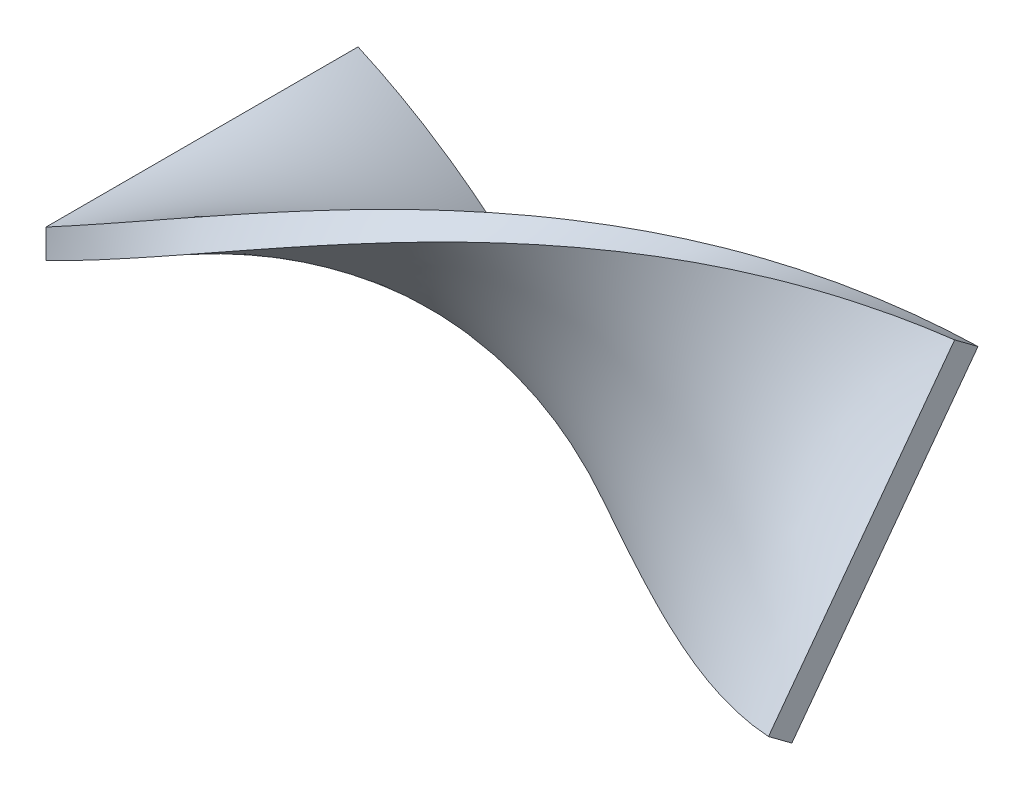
SolidWorks part; units mm, degrees
ref_plane "Front Plane" through (0, 0, 0) normal (0, 0, 1) x (1, 0, 0)
ref_plane "Top Plane" through (0, 0, 0) normal (0, 1, 0) x (1, 0, 0)
ref_plane "Right Plane" through (0, 0, 0) normal (1, 0, 0) x (0, 0, -1)
sketch "Sketch1" plane through (0, 0, 0) normal (0, 1, 0) x (1, 0, 0)
  line L0 (34.564, -16.0727) -> (-34.564, 16.0727) construction
  line L1 (-34.564, 16.0727) -> (34.564, 16.0727)
  line L2 (-34.564, 16.0727) -> (-34.564, -16.0727)
  line L3 (-34.564, -16.0727) -> (34.564, -16.0727)
  line L4 (34.564, 16.0727) -> (34.564, -16.0727)
extrude "Extrude1" add sketch "Sketch1" along normal blind 3
other "Flex3" parameters "D0"=126.624, "D1"=0, "D2"=0
